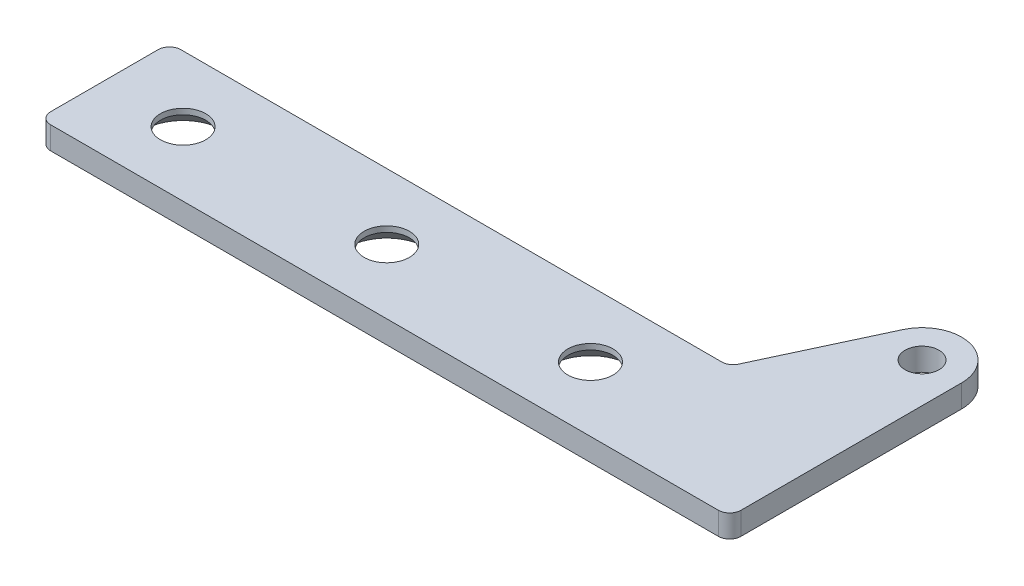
SolidWorks part; units mm, degrees
ref_plane "正面" through (0, 0, 0) normal (0, 0, 1) x (1, 0, 0)
ref_plane "平面" through (0, 0, 0) normal (0, 1, 0) x (1, 0, 0)
ref_plane "右側面" through (0, 0, 0) normal (1, 0, 0) x (0, 0, -1)
sketch "ｽｹｯﾁ1" plane through (0, 0, 0) normal (0, 1, 0) x (1, 0, 0)
  line L0 (49.4414, 11.5) -> (54.3279, 21.9792)
  line L1 (0, 0) -> (61, 0)
  line L2 (0, 0) -> (0, 11.5)
  line L3 (0, 11.5) -> (49.4414, 11.5)
  line L4 (61, 0) -> (61, 20.5)
  arc A0 (54.3279, 21.9792) -> (61, 20.5) centre (57.5, 20.5) cw
  dimension "D1" = 20.5
  dimension "D2" = 61
  dimension "D3" = 24
  dimension "D4" = 11.5
  dimension "D5" = 25
base flange "ﾍﾞｰｽ-ﾌﾗﾝｼﾞ1" sketch "ｽｹｯﾁ1" thickness 2 reverse thickness direction no parameters "D1"=0.5
break corner "ﾌﾞﾚｰｸ - ｺｰﾅｰ1" thickness 2 parameters "D1"=1, "D0"=1, "D7"=5
hole_wizard "Ø4.0 (4) 直径の穴1" positions "ｽｹｯﾁ6" profile "ｽｹｯﾁ7" hole size "Ø4.0" standard "JIS"
sketch "ｽｹｯﾁ6" plane through (0, -2, 2.5) normal (0, -1, 0) x (1, 0, 0)
  line L4 (61, -3.5) -> (61, -23) construction
  arc A0 (54.3279, -24.4792) -> (61, -23) centre (57.5, -23) ccw construction
  point P17 (7, -8.2)
  point P19 (25, -8.2)
  point P23 (43, -8.2)
  dimension "D3" = 14.8
  dimension "D1" = 18
  dimension "D2" = 18
  dimension "D4" = 18
sketch "ｽｹｯﾁ7" plane through (7, -2, -5.7) normal (1, 0, 0) x (0, 0, -1)
  line L0 (0, 0) -> (0, 2)
  line L1 (0, 2) -> (2, 2)
  line L2 (2, 2) -> (2, 1.5)
  line L3 (2, 1.5) -> (3.5, 0)
  line L5 (3.5, 0) -> (0, 0)
  line L6 (-2, 1.5) -> (-3.5, 0) construction
  line L11 (0, -6.35) -> (0, 107.95) construction
  dimension "通し穴の直径" = 4
  dimension "通し穴の深さ" = 2
  dimension "表面の皿穴の直径" = 7
  dimension "表面の皿穴の角度" = 90
sketch "ｽｹｯﾁ8" plane through (0, 0, 0) normal (0, 1, 0) x (1, 0, 0)
  circle A0 centre (57.5, 20.5) radius 1.5
  dimension "D1" = 3
extrude "ｶｯﾄ - 押し出し1" cut sketch "ｽｹｯﾁ8" against normal through all
sketch "ﾍﾞﾝﾄﾞ-ﾗｲﾝ1" [suppressed] plane through (0, 0, 0) normal (0, 1, 0) x (1, 0, 0)
sketch "境界ﾎﾞｯｸｽ1" [suppressed] plane through (0, 0, 0) normal (0, 1, 0) x (1, 0, 0)
sheet metal parameters "板金1" thickness 2 parameters "D1"=0.5
flat pattern "ﾌﾗｯﾄ-ﾊﾟﾀｰﾝ1"
sketch "ﾍﾞﾝﾄﾞ-ﾗｲﾝ2" plane through (0, 0, 0) normal (0, 1, 0) x (1, 0, 0)
sketch3d "境界ﾎﾞｯｸｽ2" [suppressed]
  line L0 (-45, 4.9998, 0) -> (5, 4.9998, 0) construction
  line L1 (-45, -20, 0) -> (5, -20, 0) construction
  line L2 (-45, 4.9998, 0) -> (-45, -20, 0) construction
  line L3 (5, 4.9998, 0) -> (5, -20, 0) construction
sheet metal parameters "板金2" thickness 2 parameters "D1"=0.5
flat pattern "ﾌﾗｯﾄ-ﾊﾟﾀｰﾝ1"
sketch "ﾍﾞﾝﾄﾞ-ﾗｲﾝ2" plane through (0, 0, 0) normal (0, 1, 0) x (1, 0, 0)
sketch3d "境界ﾎﾞｯｸｽ2" [suppressed]
  line L0 (-45, 4.9998, 0) -> (5, 4.9998, 0) construction
  line L1 (-45, -20, 0) -> (5, -20, 0) construction
  line L2 (-45, 4.9998, 0) -> (-45, -20, 0) construction
  line L3 (5, 4.9998, 0) -> (5, -20, 0) construction
sheet metal parameters "板金3" thickness 2 parameters "D1"=0.5
flat pattern "ﾌﾗｯﾄ-ﾊﾟﾀｰﾝ1"
sketch "ﾍﾞﾝﾄﾞ-ﾗｲﾝ2" plane through (0, 0, 0) normal (0, 1, 0) x (1, 0, 0)
sketch3d "境界ﾎﾞｯｸｽ2" [suppressed]
  line L0 (3.5, 3.5, 0) -> (-57.5, 3.5, 0) construction
  line L1 (3.5, -20.5, 0) -> (-57.5, -20.5, 0) construction
  line L2 (3.5, 3.5, 0) -> (3.5, -20.5, 0) construction
  line L3 (-57.5, 3.5, 0) -> (-57.5, -20.5, 0) construction
